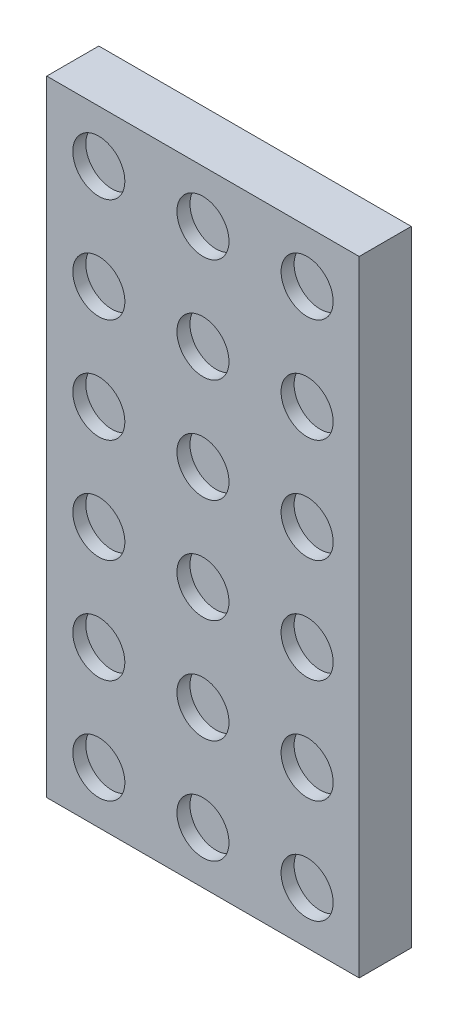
SolidWorks part; units mm, degrees
ref_plane "Front Plane" through (0, 0, 0) normal (0, 0, 1) x (1, 0, 0)
ref_plane "Top Plane" through (0, 0, 0) normal (0, 1, 0) x (1, 0, 0)
ref_plane "Right Plane" through (0, 0, 0) normal (1, 0, 0) x (0, 0, -1)
sketch "Sketch1" plane through (0, 0, 0) normal (0, 0, 1) x (1, 0, 0)
  line L1 (0, 0) -> (76.2, 0)
  line L2 (0, 0) -> (0, 152.4)
  line L3 (0, 152.4) -> (76.2, 152.4)
  line L4 (76.2, 0) -> (76.2, 152.4)
  dimension "D1" = 152.4
  dimension "D2" = 76.2
extrude "Boss-Extrude1" add sketch "Sketch1" along normal blind 12.7
sketch "Sketch3" plane through (0, 0, 12.7) normal (0, 0, 1) x (1, 0, 0)
  line L0 (0, 152.4) -> (0, 0) construction
  line L1 (76.2, 152.4) -> (0, 152.4) construction
  line L2 (0, 0) -> (76.2, 0) construction
  line L3 (25.4, 152.4) -> (25.4, 0)
  line L5 (12.7, 152.4) -> (12.7, 0)
  line L6 (38.1, 152.4) -> (38.1, 0)
  line L7 (50.8, 152.4) -> (50.8, 0)
  line L8 (63.5, 152.4) -> (63.5, 0)
  line L9 (76.2, 152.4) -> (76.2, 0)
  line L10 (88.9, 152.4) -> (88.9, 0)
  line L11 (0, 12.7) -> (76.2, 12.7)
  line L12 (76.2, 0) -> (76.2, 152.4) construction
  line L13 (0, 25.4) -> (76.2, 25.4)
  line L14 (0, 38.1) -> (76.2, 38.1)
  line L15 (0, 50.8) -> (76.2, 50.8)
  line L16 (0, 63.5) -> (76.2, 63.5)
  line L17 (0, 63.6141) -> (76.2, 63.6141)
  line L18 (0, 76.2) -> (76.2, 76.2)
  line L19 (0, 88.9) -> (76.2, 88.9)
  line L20 (0, 101.6) -> (76.2, 101.6)
  line L21 (0, 114.3) -> (76.2, 114.3)
  line L22 (0, 127) -> (76.2, 127)
  line L23 (0, 139.7) -> (76.2, 139.7)
  circle A0 centre (12.7, 139.7) radius 6.35
  circle A2 centre (38.1, 139.7) radius 6.35
  circle A4 centre (63.5, 139.7) radius 6.35
  circle A6 centre (88.9, 139.7) radius 6.35
  circle A7 centre (88.9, 114.3) radius 6.35
  circle A8 centre (63.5, 114.3) radius 6.35
  circle A9 centre (38.1, 114.3) radius 6.35
  circle A10 centre (12.7, 114.3) radius 6.35
  circle A11 centre (88.9, 88.9) radius 6.35
  circle A12 centre (63.5, 88.9) radius 6.35
  circle A13 centre (38.1, 88.9) radius 6.35
  circle A14 centre (12.7, 88.9) radius 6.35
  circle A15 centre (88.9, 63.5) radius 6.35
  circle A16 centre (63.5, 63.5) radius 6.35
  circle A17 centre (38.1, 63.5) radius 6.35
  circle A18 centre (12.7, 63.5) radius 6.35
  circle A19 centre (88.9, 38.1) radius 6.35
  circle A20 centre (63.5, 38.1) radius 6.35
  circle A21 centre (38.1, 38.1) radius 6.35
  circle A22 centre (12.7, 38.1) radius 6.35
  circle A23 centre (88.9, 12.7) radius 6.35
  circle A24 centre (63.5, 12.7) radius 6.35
  circle A25 centre (38.1, 12.7) radius 6.35
  circle A26 centre (12.7, 12.7) radius 6.35
  dimension "D1" = 12.7
  dimension "D2" = 12.7
  dimension "D3" = 12.7
  dimension "D4" = 12.7
  dimension "D5" = 12.7
  dimension "D6" = 12.7
  dimension "D7" = 12.7
  dimension "D8" = 12.7
  dimension "D9" = 12.7
  dimension "D10" = 12.7
  dimension "D11" = 12.7
  dimension "D12" = 12.7
  dimension "D13" = 12.7
  dimension "D14" = 12.7
  dimension "D15" = 12.7
  dimension "D16" = 12.7
  dimension "D17" = 12.7
  dimension "D18" = 12.7
extrude "Cut-Extrude2" cut sketch "Sketch3" against normal blind 3.175 contours A0 | A2 | A4 | A6 | A7 | A8 | A9 | A10 | A14 | A13 | A12 | A11 | A18 | A17 | A16 | A15 | A22 | A21 | A20 | A19 | A26 | A25 | A24 | A23
sketch "Sketch5" plane through (0, 0, 0) normal (0, 0, -1) x (-1, 0, 0)
  circle A0 centre (-38.1, 76.2) radius 31.75
extrude "Cut-Extrude3" cut sketch "Sketch5" against normal blind 8.89 contours A0
sketch "Sketch6" plane through (0, 0, 0) normal (0, 0, -1) x (-1, 0, 0)
  line L0 (-39.37, 0) -> (-39.37, 44.4754)
  line L1 (0, 0) -> (-76.2, 0) construction
  line L2 (-36.83, 0) -> (-36.83, 44.4754)
  line L3 (-36.83, 44.4754) -> (-39.37, 44.4754)
  line L4 (-36.83, 0) -> (-39.37, 0)
  line L5 (-76.2, 0) -> (-76.2, 152.4) construction
  circle A0 centre (-38.1, 76.2) radius 31.75 construction
  circle A1 centre (-38.1, 76.2) radius 31.75 construction
  dimension "D1" = 2.54
  dimension "D2" = 36.83
extrude "Cut-Extrude4" cut sketch "Sketch6" against normal blind 8.89
